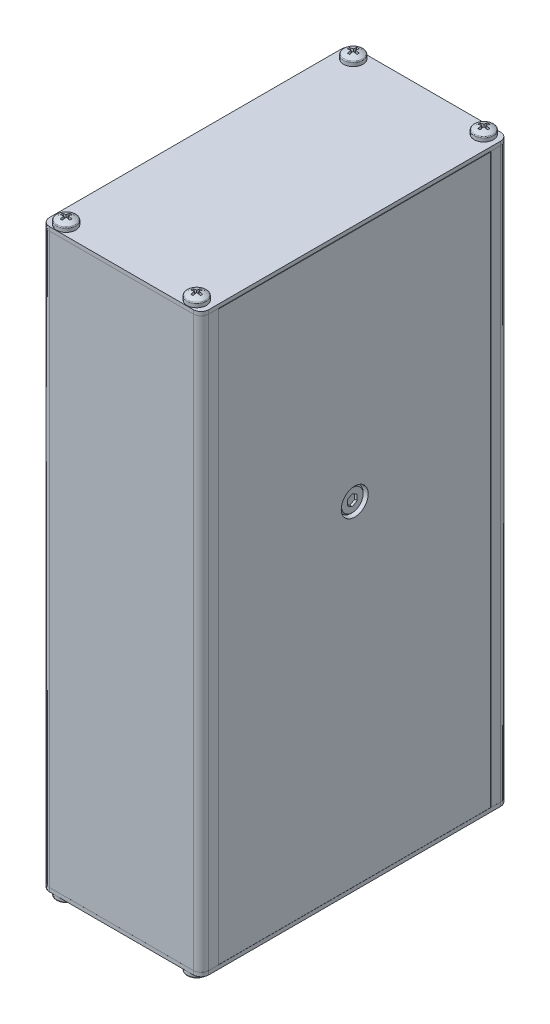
SolidWorks part; units mm, degrees
ref_plane "Front Plane" through (0, 0, 0) normal (0, 0, 1) x (1, 0, 0)
ref_plane "Top Plane" through (0, 0, 0) normal (0, 1, 0) x (1, 0, 0)
ref_plane "Right Plane" through (0, 0, 0) normal (1, 0, 0) x (0, 0, -1)
imported_body "Imported1"
imported_body "Imported2"
imported_body "Imported3"
sketch "Sketch1" plane through (28.575, 0, 0) normal (-1, 0, 0) x (0, 0, 1)
  line L0 (-38.227, -54.4322) -> (-59.436, -54.4322) construction
  line L1 (60.325, 41.9608) -> (-63.5, 41.9608)
  line L2 (60.325, 41.9608) -> (60.325, -67.1322)
  line L3 (60.325, -67.1322) -> (-63.5, -67.1322)
  line L4 (-63.5, 41.9608) -> (-63.5, -67.1322)
  line L7 (60.325, 183.576) -> (60.325, -51.3334) construction
  line L8 (-38.1, 41.9608) -> (31.75, 41.9608) construction
  line L9 (-63.5, 183.576) -> (-63.5, -51.3334) construction
  dimension "D1" = 12.7
extrude "Cut-Extrude1" cut sketch "Sketch1" along normal blind 0.0003
